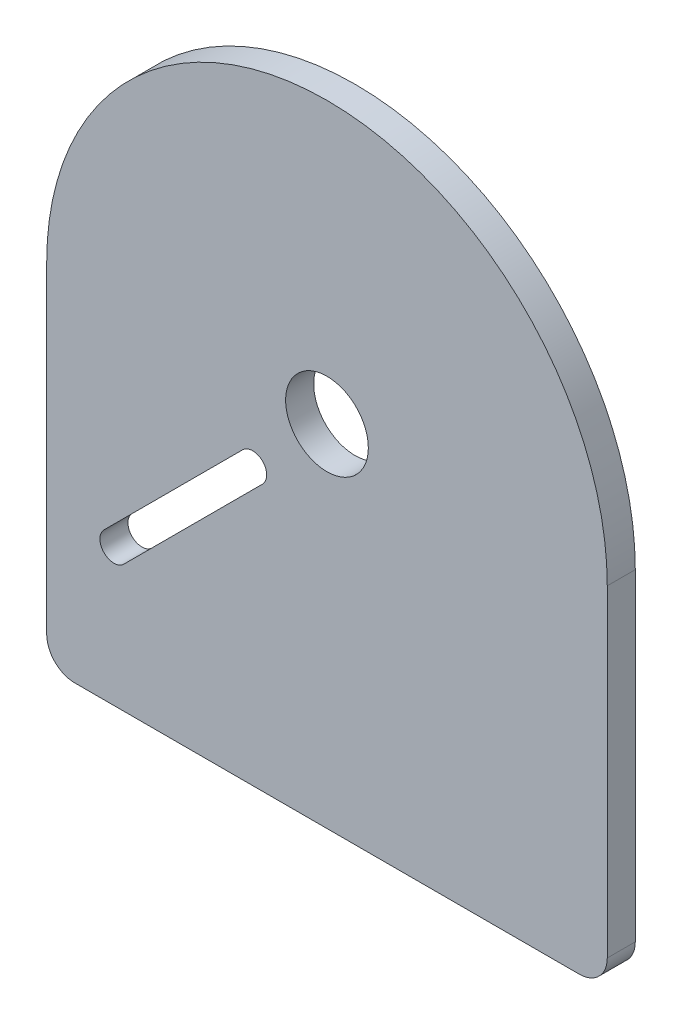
SolidWorks part; units mm, degrees
ref_plane "Plan de face" through (0, 0, 0) normal (0, 0, 1) x (1, 0, 0)
ref_plane "Plan de dessus" through (0, 0, 0) normal (0, 1, 0) x (1, 0, 0)
ref_plane "Plan de droite" through (0, 0, 0) normal (1, 0, 0) x (0, 0, -1)
sketch "Esquisse1" plane through (0, 0, 0) normal (0, 0, 1) x (1, 0, 0)
  line L1 (-6.0104, -4.5962) -> (-15.9099, -14.4957)
  line L2 (20, -23) -> (30.6364, -23) construction
  line L3 (18, -25) -> (18, -31.6007) construction
  line L4 (-26.779, -23) -> (-18, -23) construction
  line L5 (0, -25) -> (0, -27.5714) construction
  line L6 (-14.4957, -15.9099) -> (-4.5962, -6.0104)
  line L7 (-18, -23) -> (-18, -39.9089) construction
  line L11 (-18, -25) -> (18, -25)
  line L12 (-20, 0) -> (-20, -23)
  line L13 (20, 0) -> (20, -23)
  circle A0 centre (0, 0) radius 2.95
  arc A1 (20, 0) -> (-20, 0) centre (0, 0) ccw
  arc A2 (-20, -23) -> (-18, -25) centre (-18, -23) ccw
  arc A3 (20, -23) -> (18, -25) centre (18, -23) cw
  arc A4 (-4.5962, -6.0104) -> (-6.0104, -4.5962) centre (-5.3033, -5.3033) ccw
  arc A5 (-15.9099, -14.4957) -> (-14.4957, -15.9099) centre (-15.2028, -15.2028) ccw
  point P18 (-18, 18)
  point P26 (18, -23)
  dimension "D1" = 25
  dimension "D2" = 2
  dimension "D5" = 2
  dimension "D6" = 14
  dimension "D4" = 7.5
extrude "Extrusion1" add sketch "Esquisse1" along normal blind 2
